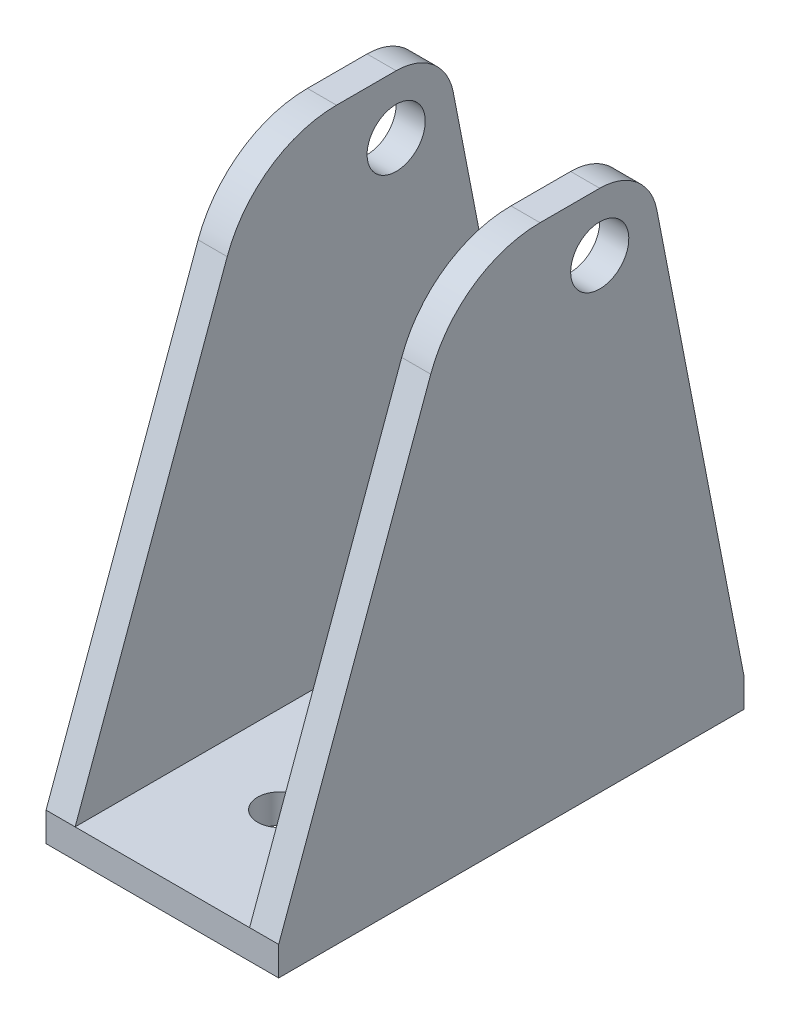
SolidWorks part; units mm, degrees
ref_plane "Front Plane" through (0, 0, 0) normal (0, 0, 1) x (1, 0, 0)
ref_plane "Top Plane" through (0, 0, 0) normal (0, 1, 0) x (1, 0, 0)
ref_plane "Right Plane" through (0, 0, 0) normal (1, 0, 0) x (0, 0, -1)
sketch "Sketch1" plane through (0, 0, 0) normal (0, 0, 1) x (1, 0, 0)
  line L0 (3.175, 0) -> (0, 0)
  line L1 (3.175, 0) -> (3.175, -53.975)
  line L2 (3.175, -53.975) -> (25.4, -53.975)
  line L3 (0, 0) -> (0, -57.15)
  line L4 (0, -57.15) -> (25.4, -57.15)
  line L5 (25.4, -53.975) -> (25.4, -57.15)
  dimension "D1" = 3.175
  dimension "D2" = 3.175
  dimension "D3" = 57.15
  dimension "D4" = 25.4
extrude "Boss-Extrude1" add sketch "Sketch1" along normal blind 38.1
sketch "Sketch2" plane through (3.175, 0, 0) normal (1, 0, 0) x (0, 0, -1)
  line L0 (-12.7, 0) -> (-6.35, 0) construction
  line L1 (-38.1, 0) -> (0, 0) construction
  line L2 (-38.1, -53.975) -> (-38.1, 0) construction
  circle A0 centre (-6.35, -6.35) radius 3.175
  dimension "D5" = 6.35
  dimension "D1" = 31.75
extrude "Cut-Extrude1" cut sketch "Sketch2" against normal up to next
sketch "Sketch3" plane through (0, -53.975, 0) normal (0, 1, 0) x (1, 0, 0)
  line L2 (25.4, -38.1) -> (25.4, 0) construction
  circle A0 centre (12.7, -3.2247) radius 2.3813
  circle A1 centre (12.7, -28.6247) radius 2.3813
  dimension "D1" = 25.4
  dimension "D3" = 4.7625
  dimension "D4" = 12.7
extrude "Cut-Extrude2" cut sketch "Sketch3" against normal up to next
sketch "Sketch4" plane through (0, 0, 0) normal (0, 0, -1) x (-1, 0, 0)
  line L6 (0, -57.15) -> (0, 0)
  line L7 (0, 0) -> (-3.175, 0)
  line L8 (-3.175, 0) -> (-3.175, -53.975)
  line L9 (-3.175, -53.975) -> (-25.4, -53.975)
  line L10 (-25.4, -53.975) -> (-25.4, -57.15)
  line L11 (-25.4, -57.15) -> (0, -57.15)
  line L12 (0, -57.15) -> (0, 0)
  line L13 (0, 0) -> (-3.175, 0)
  line L14 (-3.175, 0) -> (-3.175, -53.975)
  line L15 (-3.175, -53.975) -> (-25.4, -53.975)
  line L16 (-25.4, -53.975) -> (-25.4, -57.15)
  line L17 (-25.4, -57.15) -> (0, -57.15)
  dimension "D1" = 0
extrude "Boss-Extrude2" add sketch "Sketch4" along normal blind 9.398
sketch "Sketch5" plane through (0, 0, 38.1) normal (0, 0, 1) x (1, 0, 0)
  line L6 (0, 0) -> (0, -57.15)
  line L7 (0, -57.15) -> (25.4, -57.15)
  line L8 (25.4, -57.15) -> (25.4, -53.975)
  line L9 (25.4, -53.975) -> (3.175, -53.975)
  line L10 (3.175, -53.975) -> (3.175, 0)
  line L11 (3.175, 0) -> (0, 0)
  line L12 (0, 0) -> (0, -57.15)
  line L13 (0, -57.15) -> (25.4, -57.15)
  line L14 (25.4, -57.15) -> (25.4, -53.975)
  line L15 (25.4, -53.975) -> (3.175, -53.975)
  line L16 (3.175, -53.975) -> (3.175, 0)
  line L17 (3.175, 0) -> (0, 0)
  dimension "D1" = 0
extrude "Boss-Extrude3" add sketch "Sketch5" along normal blind 3.302
sketch "Sketch6" plane through (3.175, 0, 0) normal (1, 0, 0) x (0, 0, -1)
  line L1 (-41.402, 0) -> (-6.35, 0)
  line L13 (-11.8388, -3.1569) -> (-41.402, -53.975)
  line L14 (-41.402, -53.975) -> (-41.402, 0)
  arc A0 (-6.35, 0) -> (-11.8388, -3.1569) centre (-6.35, -6.35) ccw
extrude "Cut-Extrude3" cut sketch "Sketch6" against normal up to next
sketch "Sketch7" plane through (3.175, 0, 0) normal (1, 0, 0) x (0, 0, -1)
  line L0 (-0.1172, -5.1357) -> (9.398, -53.975)
  line L1 (9.398, -53.975) -> (9.398, 0)
  line L2 (9.398, 0) -> (-6.35, 0)
  arc A0 (-0.1172, -5.1357) -> (-6.35, 0) centre (-6.35, -6.35) ccw
extrude "Cut-Extrude4" cut sketch "Sketch7" against normal up to next
sketch "Sketch8" plane through (0, -53.975, 0) normal (0, 1, 0) x (1, 0, 0)
  line L0 (25.4, 9.398) -> (22.225, 9.398)
  line L1 (3.175, 9.398) -> (25.4, 9.398) construction
  line L2 (22.225, 9.398) -> (22.225, -41.402)
  line L3 (25.4, -41.402) -> (3.175, -41.402) construction
  line L4 (22.225, -41.402) -> (25.4, -41.402)
  line L5 (25.4, -41.402) -> (25.4, 9.398) construction
  line L6 (25.4, -41.402) -> (25.4, 9.398)
  dimension "D1" = 3.175
extrude "Boss-Extrude4" add sketch "Sketch8" along normal blind 53.975
sketch "Sketch9" plane through (22.225, 0, 0) normal (-1, 0, 0) x (0, 0, 1)
  line L1 (41.402, 0) -> (41.402, -53.975)
  line L2 (41.402, -53.975) -> (11.8388, -3.1569)
  line L3 (41.402, 0) -> (6.35, 0)
  line L4 (-9.398, 0) -> (41.402, 0) construction
  arc A0 (11.8388, -3.1569) -> (0.1172, -5.1357) centre (6.35, -6.35) ccw construction
  arc A1 (11.8388, -3.1569) -> (6.35, 0) centre (6.35, -6.35) ccw
extrude "Cut-Extrude5" cut sketch "Sketch9" against normal up to next
sketch "Sketch10" plane through (22.225, 0, 0) normal (-1, 0, 0) x (0, 0, 1)
  line L0 (6.35, 0) -> (-9.398, 0)
  line L1 (-9.398, 0) -> (-9.398, -53.975)
  line L2 (-9.398, -53.975) -> (0.1172, -5.1357)
  arc A0 (11.8388, -3.1569) -> (0.1172, -5.1357) centre (6.35, -6.35) ccw construction
  arc A1 (6.35, 0) -> (0.1172, -5.1357) centre (6.35, -6.35) ccw
  circle A2 centre (6.35, -6.35) radius 3.175
extrude "Cut-Extrude6" cut sketch "Sketch10" against normal up to next
sketch "Sketch11" plane through (25.4, 0, 0) normal (1, 0, 0) x (0, 0, -1)
  line L1 (-6.35, 0) -> (-21.7567, 0)
  line L2 (-41.402, -53.975) -> (-11.8388, -3.1569) construction
  line L4 (-41.402, -53.975) -> (-11.8388, -3.1569)
  line L7 (-41.402, -53.975) -> (9.398, -53.975) construction
  line L8 (-41.402, -53.975) -> (-21.7567, 0)
  arc A1 (-0.1172, -5.1357) -> (-11.8388, -3.1569) centre (-6.35, -6.35) ccw construction
  arc A2 (-6.35, 0) -> (-11.8388, -3.1569) centre (-6.35, -6.35) ccw
  dimension "D2" = 70
extrude "Boss-Extrude5" add sketch "Sketch11" against normal up to surface (3.175 mm away)
sketch "Sketch12" plane through (0, 0, 0) normal (-1, 0, 0) x (0, 0, 1)
  line L0 (41.402, -53.975) -> (21.7567, 0)
  line L1 (21.7567, 0) -> (6.35, 0)
  line L2 (11.8388, -3.1569) -> (41.402, -53.975) construction
  line L3 (11.8388, -3.1569) -> (41.402, -53.975)
  arc A0 (11.8388, -3.1569) -> (0.1172, -5.1357) centre (6.35, -6.35) ccw construction
  arc A1 (11.8388, -3.1569) -> (6.35, 0) centre (6.35, -6.35) ccw
extrude "Boss-Extrude7" add sketch "Sketch12" against normal up to surface (3.175 mm away)
fillet "Fillet3" radius 12.7 2 edges at (23.8125, 0, 21.7567) (1.5875, 0, 21.7567)
